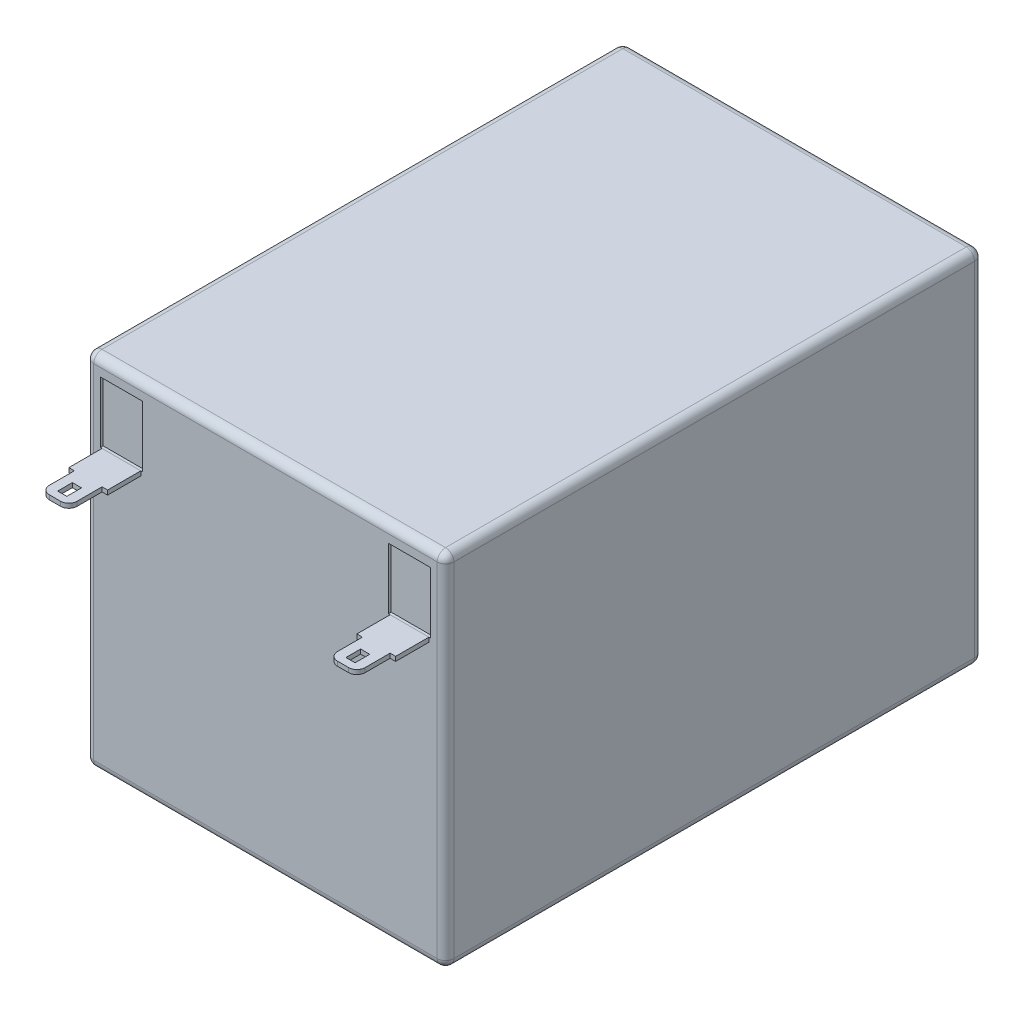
SolidWorks part; units mm, degrees
ref_plane "Plan de face" through (0, 0, 0) normal (0, 0, 1) x (1, 0, 0)
ref_plane "Plan de dessus" through (0, 0, 0) normal (0, 1, 0) x (1, 0, 0)
ref_plane "Plan de droite" through (0, 0, 0) normal (1, 0, 0) x (0, 0, -1)
sketch "Esquisse1" plane through (0, 0, 0) normal (0, 0, 1) x (1, 0, 0)
  line L1 (-22.4006, 43.3249) -> (42.5994, 43.3249)
  line L2 (-22.4006, 43.3249) -> (-22.4006, -21.6751)
  line L3 (-22.4006, -21.6751) -> (42.5994, -21.6751)
  line L4 (42.5994, 43.3249) -> (42.5994, -21.6751)
  dimension "D1" = 65
  dimension "D2" = 65
extrude "Boss.-Extru.1" add sketch "Esquisse1" along normal blind 97
fillet "Congé1" radius 1.5 12 edges at (10.0994, -21.6751, 0) (42.5994, 10.8249, 0) (10.0994, 43.3249, 0) (-22.4006, 10.8249, 0) (10.0994, 43.3249, 97) (42.5994, 10.8249, 97) (10.0994, -21.6751, 97) (-22.4006, 10.8249, 97) (-22.4006, 43.3249, 48.5) (-22.4006, -21.6751, 48.5) (42.5994, 43.3249, 48.5) (42.5994, -21.6751, 48.5)
sketch "Esquisse2" plane through (0, 0, 97) normal (0, 0, 1) x (1, 0, 0)
  line L0 (-31.6997, 29.3249) -> (58.037, 29.3249) construction
  line L1 (10.0994, 45.8729) -> (10.0994, 3.3614) construction
  line L2 (-20.9006, 43.3249) -> (41.0994, 43.3249) construction
  line L3 (42.5994, 41.8249) -> (42.5994, -20.1751) construction
  line L4 (-19.4006, 32.6044) -> (-19.4006, 25.3592) construction
  line L5 (-12.4006, 33.9138) -> (-12.4006, 22.6531) construction
  line L6 (-22.4006, -20.1751) -> (-22.4006, 41.8249) construction
  line L7 (-24.5417, 28.5249) -> (1.1223, 28.5249) construction
  line L8 (32.5994, 29.3249) -> (32.5994, 28.5249)
  line L9 (-19.4006, 29.3249) -> (-12.4006, 29.3249)
  line L10 (-19.4006, 29.3249) -> (-19.4006, 28.5249)
  line L11 (-19.4006, 28.5249) -> (-12.4006, 28.5249)
  line L12 (-12.4006, 29.3249) -> (-12.4006, 28.5249)
  line L13 (39.5994, 28.5249) -> (32.5994, 28.5249)
  line L14 (39.5994, 29.3249) -> (39.5994, 28.5249)
  line L15 (39.5994, 29.3249) -> (32.5994, 29.3249)
  dimension "D1" = 14
  dimension "D2" = 32.5
  dimension "D3" = 10
  dimension "D4" = 7
  dimension "D5" = 0.8
extrude "Boss.-Extru.2" add sketch "Esquisse2" along normal blind 12
sketch "Esquisse3" plane through (0, 43.3249, 0) normal (0, 1, 0) x (1, 0, 0)
  line L0 (10.0994, -113.2237) -> (10.0994, -50.2592) construction
  line L1 (52.1476, -103) -> (-37.4114, -103) construction
  line L2 (-22.4006, -95.5) -> (-22.4006, -1.5) construction
  line L3 (41.0994, -97) -> (-20.9006, -97) construction
  line L4 (36.0994, -111.6869) -> (36.0994, -89.152) construction
  line L5 (39.5994, -109) -> (39.5994, -97) construction
  line L6 (38.5994, -111.6869) -> (38.5994, -101.0994) construction
  line L7 (36.0994, -109.6147) -> (38.5994, -109.6147)
  line L8 (38.5994, -109.6147) -> (38.5994, -103)
  line L9 (38.5994, -103) -> (43.7404, -103)
  line L10 (43.7404, -103) -> (43.7404, -111.266)
  line L11 (43.7404, -111.266) -> (-23.5416, -111.266)
  line L12 (36.0994, -109.6147) -> (33.5994, -109.6147)
  line L13 (-15.091, -107.6721) -> (-15.091, -105.0171)
  line L14 (36.9411, -107.6721) -> (35.2898, -107.6721)
  line L15 (36.9411, -107.6721) -> (36.9411, -105.0171)
  line L16 (36.9411, -105.0171) -> (35.2898, -105.0171)
  line L17 (35.2898, -107.6721) -> (35.2898, -105.0171)
  line L18 (-16.7423, -105.0171) -> (-15.091, -105.0171)
  line L19 (-16.7423, -107.6721) -> (-16.7423, -105.0171)
  line L20 (-16.7423, -107.6721) -> (-15.091, -107.6721)
  line L21 (-23.5416, -103) -> (-23.5416, -111.266)
  line L22 (-18.4006, -103) -> (-23.5416, -103)
  line L23 (-18.4006, -109.6147) -> (-18.4006, -103)
  line L24 (-15.9006, -109.6147) -> (-18.4006, -109.6147)
  line L25 (33.5994, -112.6545) -> (33.5994, -101.5416) construction
  line L26 (31.2593, -109.6147) -> (-11.0604, -109.6147)
  line L27 (33.5994, -103) -> (31.2593, -103)
  line L28 (33.5994, -103) -> (33.5994, -109.6147)
  line L29 (-13.4006, -103) -> (-13.4006, -109.6147)
  line L30 (31.2593, -103) -> (31.2593, -109.6147)
  line L31 (-13.4006, -103) -> (-11.0604, -103)
  line L32 (-11.0604, -103) -> (-11.0604, -109.6147)
  line L33 (-13.4006, -109.6147) -> (-15.9006, -109.6147)
  point P30 (10.0994, -109.6147)
  point P31 (10.0994, -111.266)
  dimension "D1" = 32.5
  dimension "D2" = 6
  dimension "D3" = 3.5
  dimension "D4" = 2.5
  dimension "D5" = 2.5
extrude "Enlèv. mat.-Extru.1" cut sketch "Esquisse3" against normal through all
fillet "Congé2" radius 1.5 4 edges at (-18.4006, 28.9249, 109) (-13.4006, 28.9249, 109) (33.5994, 28.9249, 109) (38.5994, 28.9249, 109)
sketch "Esquisse4" plane through (0, 0, 97) normal (0, 0, 1) x (1, 0, 0)
  line L0 (10.0994, 51.6858) -> (10.0994, 17.1818) construction
  line L1 (32.2777, 29.325) -> (39.8889, 29.325)
  line L2 (32.2777, 29.325) -> (32.2777, 40.3573)
  line L3 (32.2777, 40.3573) -> (39.8889, 40.3573)
  line L4 (39.8889, 29.325) -> (39.8889, 40.3573)
  line L5 (42.5994, 41.8249) -> (42.5994, -20.1751) construction
  line L6 (-19.6901, 29.325) -> (-19.6901, 40.3573)
  line L7 (-12.0789, 40.3573) -> (-19.6901, 40.3573)
  line L8 (-12.0789, 29.325) -> (-12.0789, 40.3573)
  line L9 (-12.0789, 29.325) -> (-19.6901, 29.325)
  dimension "D1" = 32.5
extrude "Enlèv. mat.-Extru.2" cut sketch "Esquisse4" against normal blind 0.5
